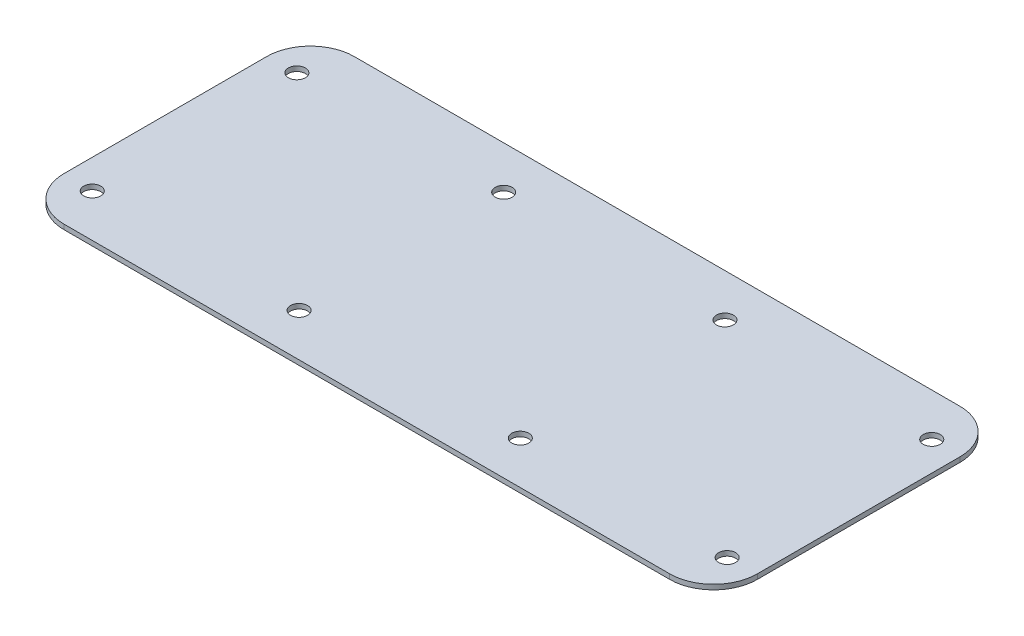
SolidWorks part; units mm, degrees
ref_plane "Front Plane" through (0, 0, 0) normal (0, 0, 1) x (1, 0, 0)
ref_plane "Top Plane" through (0, 0, 0) normal (0, 1, 0) x (1, 0, 0)
ref_plane "Right Plane" through (0, 0, 0) normal (1, 0, 0) x (0, 0, -1)
sketch "sk w14x665" plane through (0, 0, 0) normal (0, 1, 0) x (1, 0, 0)
  line L0 (-224.155, 274.828) -> (224.155, -274.828) construction
  point P1 (35.941, 0)
  line B0 (-224.155, -274.828) -> (-224.155, -160.02)
  line B1 (-224.155, -160.02) -> (-51.181, -160.02)
  line B2 (-35.941, -144.78) -> (-35.941, 144.78)
  line B3 (-51.181, 160.02) -> (-224.155, 160.02)
  line B4 (-224.155, 160.02) -> (-224.155, 274.828)
  line B5 (-224.155, 274.828) -> (224.155, 274.828)
  line B6 (224.155, 274.828) -> (224.155, 160.02)
  line B7 (224.155, 160.02) -> (51.181, 160.02)
  line B8 (35.941, 144.78) -> (35.941, -144.78)
  line B9 (51.181, -160.02) -> (224.155, -160.02)
  line B10 (224.155, -160.02) -> (224.155, -274.828)
  line B11 (224.155, -274.828) -> (-224.155, -274.828)
  line B12 (0, -346.9641) -> (0, 274.828) construction
  arc B13 (-51.181, -160.02) -> (-35.941, -144.78) centre (-51.181, -144.78) ccw
  arc B14 (-35.941, 144.78) -> (-51.181, 160.02) centre (-51.181, 144.78) ccw
  arc B15 (51.181, 160.02) -> (35.941, 144.78) centre (51.181, 144.78) ccw
  arc B16 (35.941, -144.78) -> (51.181, -160.02) centre (51.181, -144.78) ccw
sketch_block_instance "W14x665-1"
sketch_block "W14x665" parameters "D6"=15.24, "D1"=71.882, "D2"=448.31, "D3"=549.656, "D4"=114.808, "D5"=114.808, "D7"=35.941
ref_plane "midplane" through (0, 44.45, 0) normal (0, 1, 0) x (1, 0, 0)
sketch "clearance" plane through (0, 44.45, 0) normal (0, 1, 0) x (1, 0, 0)
  line L6 (-224.155, 274.828) -> (224.155, 274.828) construction
  line L7 (-224.155, 160.02) -> (-224.155, 274.828) construction
  line L8 (-51.181, 160.02) -> (-224.155, 160.02) construction
  line L9 (-35.941, -144.78) -> (-35.941, 144.78) construction
  line L10 (35.941, 144.78) -> (35.941, -144.78) construction
  line L12 (224.155, 274.828) -> (224.155, 160.02) construction
  line L13 (51.181, -160.02) -> (224.155, -160.02) construction
  line L14 (224.155, -274.828) -> (-224.155, -274.828) construction
  line L68 (-229.235, 271.5441) -> (-220.8711, 279.908)
  line L69 (-220.8711, 279.908) -> (220.8711, 279.908)
  line L70 (220.8711, 279.908) -> (229.235, 271.5441)
  line L71 (229.235, 271.5441) -> (229.235, 163.3039)
  line L72 (229.235, 163.3039) -> (220.8711, 154.94)
  line L73 (220.8711, 154.94) -> (50.0013, 154.94)
  line L74 (50.0013, 154.94) -> (41.021, 145.9597)
  line L75 (41.021, 145.9597) -> (41.021, -145.9597)
  line L76 (41.021, -145.9597) -> (50.0013, -154.94)
  line L77 (50.0013, -154.94) -> (220.8711, -154.94)
  line L78 (220.8711, -154.94) -> (229.235, -163.3039)
  line L79 (229.235, -163.3039) -> (229.235, -271.5441)
  line L80 (229.235, -271.5441) -> (220.8711, -279.908)
  line L81 (220.8711, -279.908) -> (-220.8711, -279.908)
  line L82 (-220.8711, -279.908) -> (-229.235, -271.5441)
  line L83 (-229.235, -271.5441) -> (-229.235, -163.3039)
  line L84 (-229.235, -163.3039) -> (-220.8711, -154.94)
  line L85 (-220.8711, -154.94) -> (-50.0013, -154.94)
  line L86 (-50.0013, -154.94) -> (-41.021, -145.9597)
  line L87 (-41.021, -145.9597) -> (-41.021, 145.9597)
  line L88 (-41.021, 145.9597) -> (-50.0013, 154.94)
  line L89 (-50.0013, 154.94) -> (-220.8711, 154.94)
  line L90 (-220.8711, 154.94) -> (-229.235, 163.3039)
  line L91 (-229.235, 163.3039) -> (-229.235, 271.5441)
  dimension "D3" = 1.27
  dimension "D4" = 45
  dimension "D5" = 45
  dimension "D6" = 1.27
  dimension "D7" = 5.08
  dimension "D8" = 1.27
  dimension "D9" = 5.08
  dimension "D10" = 5.08
  dimension "D11" = 5.08
  dimension "D12" = 5.08
  dimension "D13" = 1.27
  dimension "D14" = 5.08
  dimension "D15" = 1.27
  dimension "D16" = 5.08
  dimension "D17" = 12.7
  dimension "D18" = 1.27
  dimension "D19" = 5.08
  dimension "D20" = 12.7
  dimension "D21" = 12.7
  dimension "D22" = 12.7
  dimension "D23" = 1.27
  dimension "D24" = 1.27
sketch "bolt plate boundary" plane through (0, 0, 0) normal (0, 1, 0) x (1, 0, 0)
  line L7 (224.155, -274.828) -> (241.3488, -295.9087)
  line L8 (-220.8711, 279.908) -> (220.8711, 279.908) construction
  line L9 (-224.155, 274.828) -> (224.155, -274.828) construction
  line L10 (-41.021, -145.9597) -> (-41.021, 145.9597) construction
  line L11 (-224.155, 274.828) -> (-241.3488, 295.9087)
  line L12 (41.021, 145.9597) -> (41.021, -145.9597) construction
  line L15 (220.8711, -279.908) -> (-220.8711, -279.908) construction
  point P15 (0, -305.5874)
  point P16 (-66.7004, 0)
  point P17 (-308.3103, 362.8701)
  point P18 (-308.3103, 362.8701)
  point P19 (66.7004, 0)
  line B0 (-308.3103, 362.8701) -> (-350.8966, 289.1084) construction
  line B1 (-268.8989, 294.6076) -> (-229.4875, 362.8701)
  line B2 (-229.4875, 362.8701) -> (-268.8989, 431.1326)
  line B3 (-268.8989, 431.1326) -> (-347.7216, 431.1326)
  line B4 (-347.7216, 431.1326) -> (-387.133, 362.8701)
  line B5 (-387.133, 362.8701) -> (-347.7216, 294.6076)
  line B6 (-347.7216, 294.6076) -> (-268.8989, 294.6076)
  line B7 (-375.2717, 429.8316) -> (-241.3488, 295.9087) construction
  line B8 (-241.3488, 429.8316) -> (-375.2717, 295.9087) construction
  line B9 (-308.3103, 362.8701) -> (-282.9103, 362.8701) construction
  circle B10 centre (-308.3103, 362.8701) radius 44.45
  circle B11 centre (-308.3103, 362.8701) radius 68.2625 construction
  circle B12 centre (-308.3103, 362.8701) radius 85.1727
  circle B13 centre (-308.3103, 362.8701) radius 94.6977 construction
  line B14 (308.3103, -362.8701) -> (265.7239, -436.6319) construction
  line B15 (347.7216, -431.1326) -> (387.133, -362.8701)
  line B16 (387.133, -362.8701) -> (347.7216, -294.6076)
  line B17 (347.7216, -294.6076) -> (268.8989, -294.6076)
  line B18 (268.8989, -294.6076) -> (229.4875, -362.8701)
  line B19 (229.4875, -362.8701) -> (268.8989, -431.1326)
  line B20 (268.8989, -431.1326) -> (347.7216, -431.1326)
  line B21 (241.3488, -295.9087) -> (375.2717, -429.8316) construction
  line B22 (375.2717, -295.9087) -> (241.3488, -429.8316) construction
  line B23 (308.3103, -362.8701) -> (333.7103, -362.8701) construction
  circle B24 centre (308.3103, -362.8701) radius 44.45
  circle B25 centre (308.3103, -362.8701) radius 68.2625 construction
  circle B26 centre (308.3103, -362.8701) radius 85.1727
  circle B27 centre (308.3103, -362.8701) radius 94.6977 construction
  line B28 (39.4114, 468.5476) -> (-39.4114, 468.5476)
  line B29 (-78.8227, 400.2851) -> (-39.4114, 332.0226)
  line B30 (-39.4114, 332.0226) -> (39.4114, 332.0226)
  line B31 (-66.9614, 467.2466) -> (66.9614, 333.3237) construction
  line B32 (66.9614, 467.2466) -> (-66.9614, 333.3237) construction
  circle B33 centre (0, 400.2851) radius 44.45
  circle B34 centre (0, 400.2851) radius 68.2625 construction
  circle B35 centre (0, 400.2851) radius 85.1727
  circle B36 centre (0, 400.2851) radius 94.6977 construction
  line B37 (39.4114, -332.0226) -> (-39.4114, -332.0226)
  line B38 (-39.4114, -332.0226) -> (-78.8227, -400.2851)
  line B39 (-39.4114, -468.5476) -> (39.4114, -468.5476)
  line B40 (0, -400.2851) -> (25.4, -400.2851) construction
  circle B41 centre (0, -400.2851) radius 44.45
  circle B42 centre (0, -400.2851) radius 68.2625 construction
  circle B43 centre (0, -400.2851) radius 85.1727
  circle B44 centre (0, -400.2851) radius 94.6977 construction
  line B45 (-161.3981, 0) -> (-203.9845, -73.7618) construction
  line B46 (-82.5754, 0) -> (-121.9868, 68.2625)
  line B47 (-200.8095, 68.2625) -> (-240.2209, 0)
  line B48 (-240.2209, 0) -> (-200.8095, -68.2625)
  line B49 (-228.3596, 66.9614) -> (-94.4367, -66.9614) construction
  line B50 (-94.4367, 66.9614) -> (-228.3596, -66.9614) construction
  line B51 (-161.3981, 0) -> (-135.9981, 0) construction
  circle B52 centre (-161.3981, 0) radius 44.45
  circle B53 centre (-161.3981, 0) radius 68.2625 construction
  circle B54 centre (-161.3981, 0) radius 85.1727
  circle B55 centre (-161.3981, 0) radius 94.6977 construction
  line B56 (161.3981, 0) -> (118.8118, -73.7618) construction
  line B57 (200.8095, -68.2625) -> (240.2209, 0)
  line B58 (240.2209, 0) -> (200.8095, 68.2625)
  line B59 (200.8095, 68.2625) -> (121.9868, 68.2625)
  line B60 (121.9868, 68.2625) -> (82.5754, 0)
  line B61 (82.5754, 0) -> (121.9868, -68.2625)
  line B62 (94.4367, 66.9614) -> (228.3596, -66.9614) construction
  line B63 (228.3596, 66.9614) -> (94.4367, -66.9614) construction
  line B64 (161.3981, 0) -> (186.7981, 0) construction
  circle B65 centre (161.3981, 0) radius 44.45
  circle B66 centre (161.3981, 0) radius 68.2625 construction
  circle B67 centre (161.3981, 0) radius 85.1727
  circle B68 centre (161.3981, 0) radius 94.6977 construction
  dimension "D1" = 27.2034
  dimension "D2" = 25.6794
  dimension "D3" = 25.6794
  dimension "D4" = 25.6794
  dimension "D5" = 25.6794
  dimension "D6" = 27.2034
sketch_block_instance "3.5in bolt-3"
sketch_block "3.5in bolt" parameters "D1"=88.9, "D2"=136.525, "D3"=6.35, "D4"=40.7227, "D5"=45, "D6"=9.525
sketch_block_instance "3.5in bolt-4"
sketch_block_instance "3.5in bolt-5"
sketch_block_instance "3.5in bolt-6"
sketch_block_instance "3.5in bolt-7"
sketch_block_instance "3.5in bolt-8"
sketch "Sketch4" plane through (0, 0, 0) normal (0, 1, 0) x (1, 0, 0)
  line L1 (-403.008, 494.9829) -> (1520.1847, 494.9829)
  line L2 (-403.008, 494.9829) -> (-403.008, -494.9829)
  line L3 (-403.008, -494.9829) -> (1520.1847, -494.9829)
  line L4 (1520.1847, 494.9829) -> (1520.1847, -494.9829)
  circle A2 centre (0, 400.2851) radius 94.6977 construction
  circle A3 centre (-308.3103, 362.8701) radius 94.6977 construction
  circle A4 centre (0, -400.2851) radius 94.6977 construction
  dimension "D1" = 1358.7865
extrude "main plate" add sketch "Sketch4" along normal blind 12.7
sketch "sk bolt holes" plane through (0, 0, 0) normal (0, 1, 0) x (1, 0, 0)
  line L0 (808.8664, 362.8701) -> (808.8664, -362.8701) construction
  circle B0 centre (-308.3103, 362.8701) radius 46.0375
  circle B1 centre (0, 400.2851) radius 46.0375
  circle B2 centre (308.3103, 362.8701) radius 46.0375
  circle B3 centre (-308.3103, -362.8701) radius 46.0375
  circle B4 centre (0, -400.2851) radius 46.0375
  circle B5 centre (-161.3981, 0) radius 46.0375
  circle B6 centre (161.3981, 0) radius 46.0375
  circle B7 centre (308.3103, -362.8701) radius 46.0375
  circle B8 centre (0, 0) radius 76.2 construction
  circle B9 centre (808.8664, 362.8701) radius 46.0375
  circle B10 centre (1117.1767, 400.2851) radius 46.0375
  circle B11 centre (1425.4869, 362.8701) radius 46.0375
  circle B12 centre (808.8664, -362.8701) radius 46.0375
  circle B13 centre (1117.1767, -400.2851) radius 46.0375
  circle B14 centre (955.7785, 0) radius 46.0375
  circle B15 centre (1278.5748, 0) radius 46.0375
  circle B16 centre (1425.4869, -362.8701) radius 46.0375
  circle B17 centre (1117.1767, 0) radius 76.2 construction
  dimension "D1" = 1117.1767
sketch_block_instance "Block1-1"
sketch_block "Block1" parameters "D1"=92.075, "D2"=92.075, "D3"=92.075, "D4"=92.075, "D5"=92.075, "D6"=92.075, "D7"=92.075, "D8"=92.075, "D9"=152.4
sketch_block_instance "Block1-2"
extrude "Cut-Extrude2" [suppressed] cut sketch "sk bolt holes" along normal blind 88.9
fillet "Fillet1" radius 139.7 4 edges at (-403.008, 6.35, -494.9829) (1520.1847, 6.35, -494.9829) (1520.1847, 6.35, 494.9829) (-403.008, 6.35, 494.9829)
sketch "Sketch5" [suppressed] plane through (0, 9.525, 0) normal (0, 1, 0) x (1, 0, 0)
  line L1 (-517.2218, 542.3296) -> (487.0923, 542.3296)
  line L2 (-517.2218, 542.3296) -> (-517.2218, -547.3512)
  line L3 (-517.2218, -547.3512) -> (487.0923, -547.3512)
  line L4 (487.0923, 542.3296) -> (487.0923, -547.3512)
sketch "Sketch6" [suppressed] plane through (0, 0, 0) normal (0, 1, 0) x (1, 0, 0)
  line L0 (403.008, 355.2829) -> (403.008, -355.2829)
  line L1 (263.308, -494.9829) -> (172.4355, -494.9829) construction
  line L2 (263.308, 494.9829) -> (172.4355, 494.9829) construction
  line L3 (-403.008, 494.9829) -> (-403.008, -494.9829) construction
  line L4 (-403.008, 494.9829) -> (1520.1847, 494.9829) construction
  line L5 (-403.008, -494.9829) -> (1520.1847, -494.9829) construction
  line L6 (263.308, 494.9829) -> (263.308, 570.7306)
  line L7 (263.308, 570.7306) -> (1614.8608, 570.7306)
  line L8 (1614.8608, 570.7306) -> (1614.8608, -623.6767)
  line L9 (1614.8608, -623.6767) -> (263.308, -623.6767)
  line L10 (263.308, -623.6767) -> (263.308, -494.9829)
  arc A0 (403.008, -355.2829) -> (263.308, -494.9829) centre (263.308, -355.2829) cw
  arc A1 (403.008, 355.2829) -> (263.308, 494.9829) centre (263.308, 355.2829) ccw
  dimension "D2" = 139.7
  dimension "D1" = 806.016
extrude "Cut-Extrude3" [suppressed] cut sketch "Sketch6" along normal blind 25.4
sketch "Sketch7" plane through (0, 0, 0) normal (0, 1, 0) x (1, 0, 0)
  line L0 (-263.308, -494.9829) -> (1380.4847, -494.9829) construction
  line L1 (1380.4847, 494.9829) -> (-263.308, 494.9829) construction
  line L2 (1520.1847, -355.2829) -> (1520.1847, 355.2829) construction
  point P0 (0, 494.9829)
  point P4 (1117.1767, 494.9829)
  line B0 (403.008, 368.6679) -> (403.008, -368.6679)
  line B1 (314.108, -457.5679) -> (108.1676, -457.5679)
  line B2 (63.2663, -476.1666) -> (63.0487, -476.3842)
  line B3 (18.1474, -494.9829) -> (-18.1474, -494.9829)
  line B4 (-63.0487, -476.3842) -> (-63.2663, -476.1666)
  line B5 (-108.1676, -457.5679) -> (-314.108, -457.5679)
  line B6 (-403.008, -368.6679) -> (-403.008, 368.6679)
  line B7 (-314.108, 457.5679) -> (-108.1676, 457.5679)
  line B8 (-63.2663, 476.1666) -> (-63.0487, 476.3842)
  line B9 (-18.1474, 494.9829) -> (18.1474, 494.9829)
  line B10 (63.0487, 476.3842) -> (63.2663, 476.1666)
  line B11 (108.1676, 457.5679) -> (314.108, 457.5679)
  line B12 (-573.1445, 780.0685) -> (706.3295, 780.0685)
  line B13 (-573.1445, 780.0685) -> (-573.1445, -757.0177)
  line B14 (-573.1445, -757.0177) -> (706.3295, -757.0177)
  line B15 (706.3295, 780.0685) -> (706.3295, -757.0177)
  arc B16 (108.1676, -457.5679) -> (63.2663, -476.1666) centre (108.1676, -521.0679) ccw
  arc B17 (63.0487, -476.3842) -> (18.1474, -494.9829) centre (18.1474, -431.4829) cw
  arc B18 (-18.1474, -494.9829) -> (-63.0487, -476.3842) centre (-18.1474, -431.4829) cw
  arc B19 (-63.2663, -476.1666) -> (-108.1676, -457.5679) centre (-108.1676, -521.0679) ccw
  arc B20 (403.008, -368.6679) -> (314.108, -457.5679) centre (314.108, -368.6679) cw
  arc B21 (-314.108, -457.5679) -> (-403.008, -368.6679) centre (-314.108, -368.6679) cw
  arc B22 (403.008, 368.6679) -> (314.108, 457.5679) centre (314.108, 368.6679) ccw
  arc B23 (-403.008, 368.6679) -> (-314.108, 457.5679) centre (-314.108, 368.6679) cw
  arc B24 (63.2663, 476.1666) -> (108.1676, 457.5679) centre (108.1676, 521.0679) ccw
  arc B25 (18.1474, 494.9829) -> (63.0487, 476.3842) centre (18.1474, 431.4829) cw
  arc B26 (-63.0487, 476.3842) -> (-18.1474, 494.9829) centre (-18.1474, 431.4829) cw
  arc B27 (-108.1676, 457.5679) -> (-63.2663, 476.1666) centre (-108.1676, 521.0679) ccw
  line B28 (1520.1847, 368.6679) -> (1520.1847, -368.6679)
  line B29 (1431.2847, -457.5679) -> (1225.3442, -457.5679)
  line B30 (1099.0292, 494.9829) -> (1135.3241, 494.9829)
  line B31 (544.0322, 780.0685) -> (544.0322, -757.0177)
  line B32 (1823.5061, 780.0685) -> (1823.5061, -757.0177)
  arc B33 (1099.0292, -494.9829) -> (1054.1279, -476.3842) centre (1099.0292, -431.4829) cw
  arc B34 (1520.1847, 368.6679) -> (1431.2847, 457.5679) centre (1431.2847, 368.6679) ccw
  arc B35 (1180.443, 476.1666) -> (1225.3442, 457.5679) centre (1225.3442, 521.0679) ccw
  arc B36 (1135.3241, 494.9829) -> (1180.2254, 476.3842) centre (1135.3241, 431.4829) cw
  arc B37 (1054.1279, 476.3842) -> (1099.0292, 494.9829) centre (1099.0292, 431.4829) cw
sketch_block_instance "Block2-1"
sketch_block "Block2"
sketch_block_instance "Block2-3"
sketch "Sketch9" plane through (0, 0, 0) normal (0, 1, 0) x (1, 0, 0)
  line L0 (-403.008, 368.6679) -> (-403.008, -368.6679)
  line L1 (-314.108, -457.5679) -> (-108.1676, -457.5679)
  line L2 (-63.2663, -476.1666) -> (-63.0487, -476.3842)
  line L3 (-18.1474, -494.9829) -> (1135.3241, -494.9829)
  line L4 (1180.2254, -476.3842) -> (1180.443, -476.1666)
  line L5 (1225.3442, -457.5679) -> (1431.2847, -457.5679)
  line L6 (1520.1847, -368.6679) -> (1520.1847, 368.6679)
  line L7 (1431.2847, 457.5679) -> (1225.3442, 457.5679)
  line L8 (1180.443, 476.1666) -> (1180.2254, 476.3842)
  line L9 (1135.3241, 494.9829) -> (-18.1474, 494.9829)
  line L10 (-63.0487, 476.3842) -> (-63.2663, 476.1666)
  line L11 (-108.1676, 457.5679) -> (-314.108, 457.5679)
  line L13 (108.1676, 457.5679) -> (314.108, 457.5679) construction
  line L14 (-403.008, -368.6679) -> (-403.008, 368.6679) construction
  line L15 (1520.1847, 368.6679) -> (1520.1847, -368.6679) construction
  line L16 (-314.108, 457.5679) -> (-108.1676, 457.5679) construction
  line L17 (-108.1676, -457.5679) -> (-314.108, -457.5679) construction
  line L18 (-18.1474, 494.9829) -> (18.1474, 494.9829) construction
  line L20 (-465.7609, 588.4229) -> (1596.5512, 588.4229)
  line L21 (-465.7609, 588.4229) -> (-465.7609, -605.7123)
  line L22 (-465.7609, -605.7123) -> (1596.5512, -605.7123)
  line L23 (1596.5512, 588.4229) -> (1596.5512, -605.7123)
  arc A0 (-403.008, -368.6679) -> (-314.108, -457.5679) centre (-314.108, -368.6679) ccw
  arc A1 (1431.2847, -457.5679) -> (1520.1847, -368.6679) centre (1431.2847, -368.6679) ccw
  arc A2 (1520.1847, 368.6679) -> (1431.2847, 457.5679) centre (1431.2847, 368.6679) ccw
  arc A3 (-314.108, 457.5679) -> (-403.008, 368.6679) centre (-314.108, 368.6679) ccw
  arc A4 (-108.1676, -457.5679) -> (-63.2663, -476.1666) centre (-108.1676, -521.0679) cw
  arc A5 (-63.0487, -476.3842) -> (-18.1474, -494.9829) centre (-18.1474, -431.4829) ccw
  arc A6 (1135.3241, -494.9829) -> (1180.2254, -476.3842) centre (1135.3241, -431.4829) ccw
  arc A7 (1180.443, -476.1666) -> (1225.3442, -457.5679) centre (1225.3442, -521.0679) cw
  arc A8 (1225.3442, 457.5679) -> (1180.443, 476.1666) centre (1225.3442, 521.0679) cw
  arc A9 (1180.2254, 476.3842) -> (1135.3241, 494.9829) centre (1135.3241, 431.4829) ccw
  arc A10 (-18.1474, 494.9829) -> (-63.0487, 476.3842) centre (-18.1474, 431.4829) ccw
  arc A11 (-63.2663, 476.1666) -> (-108.1676, 457.5679) centre (-108.1676, 521.0679) cw
  dimension "D2" = 88.9
  dimension "D3" = 63.5
  dimension "D1" = 45
extrude "Cut-Extrude4" cut sketch "Sketch9" along normal blind 25.4
sketch "Sketch10" plane through (0, 0, 0) normal (0, 1, 0) x (1, 0, 0)
  line L13 (-644.5898, 615.729) -> (1787.4754, 615.729)
  line L14 (-644.5898, 615.729) -> (-644.5898, -731.4192)
  line L15 (-644.5898, -731.4192) -> (1787.4754, -731.4192)
  line L16 (1787.4754, 615.729) -> (1787.4754, -731.4192)
  line L24 (1225.3442, -444.8679) -> (1431.2847, -444.8679)
  line L25 (1171.2451, -467.4039) -> (1171.4627, -467.1863)
  line L26 (-18.1474, -482.2829) -> (1135.3241, -482.2829)
  line L27 (-54.286, -467.1863) -> (-54.0685, -467.4039)
  line L28 (-314.108, -444.8679) -> (-108.1676, -444.8679)
  line L29 (-390.308, 355.2829) -> (-390.308, -355.2829)
  line L30 (-108.1676, 444.8679) -> (-314.108, 444.8679)
  line L31 (-54.0685, 467.4039) -> (-54.286, 467.1863)
  line L32 (1135.3241, 482.2829) -> (-18.1474, 482.2829)
  line L33 (1171.4627, 467.1863) -> (1171.2451, 467.4039)
  line L34 (1431.2847, 444.8679) -> (1225.3442, 444.8679)
  line L35 (1507.4847, -355.2829) -> (1507.4847, 355.2829)
  line L36 (1225.3442, -444.8679) -> (1431.2847, -444.8679)
  line L37 (1171.2451, -467.4039) -> (1171.4627, -467.1863)
  line L38 (-18.1474, -482.2829) -> (1135.3241, -482.2829)
  line L39 (-54.286, -467.1863) -> (-54.0685, -467.4039)
  line L40 (-314.108, -444.8679) -> (-108.1676, -444.8679)
  line L41 (-390.308, 355.2829) -> (-390.308, -355.2829)
  line L42 (-108.1676, 444.8679) -> (-314.108, 444.8679)
  line L43 (-54.0685, 467.4039) -> (-54.286, 467.1863)
  line L44 (1135.3241, 482.2829) -> (-18.1474, 482.2829)
  line L45 (1171.4627, 467.1863) -> (1171.2451, 467.4039)
  line L46 (1431.2847, 444.8679) -> (1225.3442, 444.8679)
  line L47 (1507.4847, -355.2829) -> (1507.4847, 355.2829)
  arc A32 (-377.3411, -411.1887) -> (-314.108, -444.8679) centre (-314.108, -368.6679) ccw
  arc A33 (1431.2847, -444.8679) -> (1494.5178, -411.1887) centre (1431.2847, -368.6679) ccw
  arc A34 (1225.3442, -444.8679) -> (1171.4627, -467.1863) centre (1225.3442, -521.0679) ccw
  arc A35 (1135.3241, -482.2829) -> (1171.2451, -467.4039) centre (1135.3241, -431.4829) ccw
  arc A36 (-54.0685, -467.4039) -> (-18.1474, -482.2829) centre (-18.1474, -431.4829) ccw
  arc A37 (-54.286, -467.1863) -> (-108.1676, -444.8679) centre (-108.1676, -521.0679) ccw
  arc A38 (-390.308, -355.2829) -> (-377.3411, -411.1887) centre (-263.308, -355.2829) ccw
  arc A39 (-377.3411, 411.1887) -> (-390.308, 355.2829) centre (-263.308, 355.2829) ccw
  arc A40 (1494.5178, 411.1887) -> (1431.2847, 444.8679) centre (1431.2847, 368.6679) ccw
  arc A41 (-314.108, 444.8679) -> (-377.3411, 411.1887) centre (-314.108, 368.6679) ccw
  arc A42 (-108.1676, 444.8679) -> (-54.286, 467.1863) centre (-108.1676, 521.0679) ccw
  arc A43 (-18.1474, 482.2829) -> (-54.0685, 467.4039) centre (-18.1474, 431.4829) ccw
  arc A44 (1171.2451, 467.4039) -> (1135.3241, 482.2829) centre (1135.3241, 431.4829) ccw
  arc A45 (1171.4627, 467.1863) -> (1225.3442, 444.8679) centre (1225.3442, 521.0679) ccw
  arc A46 (1507.4847, 355.2829) -> (1494.5178, 411.1887) centre (1380.4847, 355.2829) ccw
  arc A47 (1494.5178, -411.1887) -> (1507.4847, -355.2829) centre (1380.4847, -355.2829) ccw
  arc A48 (-377.3411, -411.1887) -> (-314.108, -444.8679) centre (-314.108, -368.6679) ccw
  arc A49 (1431.2847, -444.8679) -> (1494.5178, -411.1887) centre (1431.2847, -368.6679) ccw
  arc A50 (1225.3442, -444.8679) -> (1171.4627, -467.1863) centre (1225.3442, -521.0679) ccw
  arc A51 (1135.3241, -482.2829) -> (1171.2451, -467.4039) centre (1135.3241, -431.4829) ccw
  arc A52 (-54.0685, -467.4039) -> (-18.1474, -482.2829) centre (-18.1474, -431.4829) ccw
  arc A53 (-54.286, -467.1863) -> (-108.1676, -444.8679) centre (-108.1676, -521.0679) ccw
  arc A54 (-390.308, -355.2829) -> (-377.3411, -411.1887) centre (-263.308, -355.2829) ccw
  arc A55 (-377.3411, 411.1887) -> (-390.308, 355.2829) centre (-263.308, 355.2829) ccw
  arc A56 (1494.5178, 411.1887) -> (1431.2847, 444.8679) centre (1431.2847, 368.6679) ccw
  arc A57 (-314.108, 444.8679) -> (-377.3411, 411.1887) centre (-314.108, 368.6679) ccw
  arc A58 (-108.1676, 444.8679) -> (-54.286, 467.1863) centre (-108.1676, 521.0679) ccw
  arc A59 (-18.1474, 482.2829) -> (-54.0685, 467.4039) centre (-18.1474, 431.4829) ccw
  arc A60 (1171.2451, 467.4039) -> (1135.3241, 482.2829) centre (1135.3241, 431.4829) ccw
  arc A61 (1171.4627, 467.1863) -> (1225.3442, 444.8679) centre (1225.3442, 521.0679) ccw
  arc A62 (1507.4847, 355.2829) -> (1494.5178, 411.1887) centre (1380.4847, 355.2829) ccw
  arc A63 (1494.5178, -411.1887) -> (1507.4847, -355.2829) centre (1380.4847, -355.2829) ccw
  dimension "D1" = 12.7
extrude "Cut-Extrude5" cut sketch "Sketch10" along normal through all
sketch "Sketch11" plane through (0, 0, 0) normal (0, 1, 0) x (1, 0, 0)
  circle A2 centre (-308.3103, 362.8701) radius 46.0375 construction
  circle A3 centre (0, 400.2851) radius 46.0375 construction
  circle A4 centre (308.3103, 362.8701) radius 46.0375 construction
  circle A5 centre (-161.3981, 0) radius 46.0375 construction
  circle A6 centre (161.3981, 0) radius 46.0375 construction
  circle A7 centre (-308.3103, -362.8701) radius 46.0375 construction
  circle A8 centre (0, -400.2851) radius 46.0375 construction
  circle A9 centre (308.3103, -362.8701) radius 46.0375 construction
  circle A10 centre (1425.4869, 362.8701) radius 46.0375 construction
  circle A11 centre (1117.1767, 400.2851) radius 46.0375 construction
  circle A12 centre (808.8664, 362.8701) radius 46.0375 construction
  circle A13 centre (955.7785, 0) radius 46.0375 construction
  circle A14 centre (1278.5748, 0) radius 46.0375 construction
  circle A15 centre (808.8664, -362.8701) radius 46.0375 construction
  circle A16 centre (1117.1767, -400.2851) radius 46.0375 construction
  circle A17 centre (1425.4869, -362.8701) radius 46.0375 construction
  circle B0 centre (-308.3103, 362.8701) radius 35.7188
  circle B1 centre (-308.3103, 362.8701) radius 46.99
  circle B2 centre (308.3103, 362.8701) radius 35.7188
  circle B3 centre (308.3103, 362.8701) radius 46.99
  circle B4 centre (0, 400.2851) radius 35.7188
  circle B5 centre (0, 400.2851) radius 46.99
  circle B6 centre (-161.3981, 0) radius 35.7188
  circle B7 centre (-161.3981, 0) radius 46.99
  circle B8 centre (161.3981, 0) radius 35.7188
  circle B9 centre (161.3981, 0) radius 46.99
  circle B10 centre (-308.3103, -362.8701) radius 35.7188
  circle B11 centre (-308.3103, -362.8701) radius 46.99
  circle B12 centre (0, -400.2851) radius 35.7188
  circle B13 centre (0, -400.2851) radius 46.99
  circle B14 centre (308.3103, -362.8701) radius 35.7188
  circle B15 centre (308.3103, -362.8701) radius 46.99
  circle B16 centre (1425.4869, 362.8701) radius 35.7188
  circle B17 centre (1425.4869, 362.8701) radius 46.99
  circle B18 centre (1117.1767, 400.2851) radius 35.7188
  circle B19 centre (1117.1767, 400.2851) radius 46.99
  circle B20 centre (808.8664, 362.8701) radius 35.7188
  circle B21 centre (808.8664, 362.8701) radius 46.99
  circle B22 centre (955.7785, 0) radius 35.7188
  circle B23 centre (955.7785, 0) radius 46.99
  circle B24 centre (1278.5748, 0) radius 35.7188
  circle B25 centre (1278.5748, 0) radius 46.99
  circle B26 centre (808.8664, -362.8701) radius 35.7188
  circle B27 centre (808.8664, -362.8701) radius 46.99
  circle B28 centre (1117.1767, -400.2851) radius 35.7188
  circle B29 centre (1117.1767, -400.2851) radius 46.99
  circle B30 centre (1425.4869, -362.8701) radius 35.7188
  circle B31 centre (1425.4869, -362.8701) radius 46.99
sketch_block_instance "Block3-1"
sketch_block "Block3" parameters "D1"=71.4375, "D2"=93.98
sketch_block_instance "Block3-2"
sketch_block_instance "Block3-3"
sketch_block_instance "Block3-4"
sketch_block_instance "Block3-5"
sketch_block_instance "Block3-6"
sketch_block_instance "Block3-7"
sketch_block_instance "Block3-8"
sketch_block_instance "Block3-9"
sketch_block_instance "Block3-10"
sketch_block_instance "Block3-11"
sketch_block_instance "Block3-12"
sketch_block_instance "Block3-13"
sketch_block_instance "Block3-14"
sketch_block_instance "Block3-15"
sketch_block_instance "Block3-16"
extrude "Boss-Extrude1" [suppressed] add sketch "Sketch11" along normal blind 12.7
sketch "Sketch13" plane through (0, 0, 0) normal (0, 1, 0) x (1, 0, 0)
  line L0 (-284.2097, 311.9592) -> (284.2097, -311.9592) construction
  line L1 (284.2097, -311.9592) -> (-284.2097, -311.9592) construction
  line L2 (832.967, 311.9592) -> (1401.3864, -311.9592) construction
  line L3 (1401.3864, -311.9592) -> (832.967, -311.9592) construction
  point P5 (1117.1767, 0)
  point P7 (0, 0)
  circle B0 centre (-284.2097, 311.9592) radius 32.5438
  circle B1 centre (0, 347.5192) radius 32.5437
  circle B2 centre (284.2097, 311.9592) radius 32.5438
  circle B3 centre (-161.544, 0) radius 32.5437
  circle B4 centre (161.544, 0) radius 32.5438
  circle B5 centre (284.2097, -311.9592) radius 32.5437
  circle B6 centre (0, -347.5192) radius 32.5437
  circle B7 centre (-284.2097, -311.9592) radius 32.5438
  circle B8 centre (832.967, 311.9592) radius 32.5438
  circle B9 centre (1117.1767, 347.5192) radius 32.5437
  circle B10 centre (1401.3864, 311.9592) radius 32.5438
  circle B11 centre (955.6327, 0) radius 32.5437
  circle B12 centre (1278.7207, 0) radius 32.5438
  circle B13 centre (1401.3864, -311.9592) radius 32.5437
  circle B14 centre (1117.1767, -347.5192) radius 32.5437
  circle B15 centre (832.967, -311.9592) radius 32.5438
sketch_block_instance "Block5-1"
sketch_block "Block5" parameters "D1"=65.0875, "D2"=65.0875, "D3"=65.0875, "D4"=65.0875, "D5"=65.0875, "D6"=65.0875, "D7"=65.0875, "D8"=65.0875
sketch_block_instance "Block5-2"
sketch "mountplates" plane through (0, 0, 0) normal (0, 1, 0) x (1, 0, 0)
  line L0 (-246.1097, 309.4192) -> (246.1097, -309.4192) construction
  line L10 (871.067, 309.4192) -> (1363.2864, -309.4192) construction
  point P2 (0, 0)
  point P5 (1117.1767, 0)
  line B0 (-246.1097, 423.7192) -> (246.1097, 423.7192)
  line B1 (-360.4097, 309.4192) -> (-360.4097, -309.4192)
  line B2 (-246.1097, -423.7192) -> (246.1097, -423.7192)
  line B3 (360.4097, 309.4192) -> (360.4097, -309.4192)
  arc B4 (-360.4097, -309.4192) -> (-246.1097, -423.7192) centre (-246.1097, -309.4192) ccw
  arc B5 (246.1097, -423.7192) -> (360.4097, -309.4192) centre (246.1097, -309.4192) ccw
  arc B6 (246.1097, 423.7192) -> (360.4097, 309.4192) centre (246.1097, 309.4192) cw
  arc B7 (-246.1097, 423.7192) -> (-360.4097, 309.4192) centre (-246.1097, 309.4192) ccw
  line B8 (871.067, 423.7192) -> (1363.2864, 423.7192)
  line B9 (756.767, 309.4192) -> (756.767, -309.4192)
  line B10 (871.067, -423.7192) -> (1363.2864, -423.7192)
  line B11 (1477.5864, 309.4192) -> (1477.5864, -309.4192)
  arc B12 (756.767, -309.4192) -> (871.067, -423.7192) centre (871.067, -309.4192) ccw
sketch_block_instance "Block6-1"
sketch_block "Block6" parameters "D1"=114.3, "D2"=720.8194, "D3"=847.4384
sketch_block_instance "Block6-2"
sketch "Sketch15" plane through (0, 0, 0) normal (0, 1, 0) x (1, 0, 0)
  line L0 (-246.1097, 423.7192) -> (246.1097, 423.7192) construction
  line L1 (-246.1097, 423.7192) -> (1363.2864, 423.7192)
  line L2 (-360.4097, 309.4192) -> (-360.4097, -309.4192)
  line L3 (-246.1097, -423.7192) -> (1363.2864, -423.7192)
  line L4 (1477.5864, 309.4192) -> (1477.5864, -309.4192)
  line L5 (-360.4097, 309.4192) -> (-360.4097, -309.4192) construction
  line L6 (-246.1097, -423.7192) -> (246.1097, -423.7192) construction
  line L7 (1477.5864, 309.4192) -> (1477.5864, -309.4192) construction
  line L9 (-507.665, 564.7648) -> (1634.7064, 564.7648)
  line L10 (-507.665, 564.7648) -> (-507.665, -637.7083)
  line L11 (-507.665, -637.7083) -> (1634.7064, -637.7083)
  line L12 (1634.7064, 564.7648) -> (1634.7064, -637.7083)
  arc A0 (1363.2864, -423.7192) -> (1477.5864, -309.4192) centre (1363.2864, -309.4192) ccw
  arc A1 (1363.2864, 423.7192) -> (1477.5864, 309.4192) centre (1363.2864, 309.4192) cw
  arc A2 (-360.4097, -309.4192) -> (-246.1097, -423.7192) centre (-246.1097, -309.4192) ccw
  arc A3 (-246.1097, 423.7192) -> (-360.4097, 309.4192) centre (-246.1097, 309.4192) ccw
  dimension "D1" = 114.3
extrude "Cut-Extrude6" [suppressed] cut sketch "Sketch13" along normal through all
extrude "Cut-Extrude7" [suppressed] cut sketch "Sketch15" along normal through all
sketch "Sketch16" plane through (0, 0, 0) normal (0, 1, 0) x (1, 0, 0)
  line L0 (-279.6377, 297.9892) -> (279.6377, -297.9892) construction
  line L1 (279.6377, -297.9892) -> (-279.6377, -297.9892) construction
  line L2 (837.539, 297.9892) -> (1396.8144, -297.9892) construction
  line L3 (1396.8144, -297.9892) -> (837.539, -297.9892) construction
  point P6 (0, 0)
  point P7 (1117.1767, 0)
  circle B0 centre (-279.6377, 297.9892) radius 29.3687
  circle B1 centre (0, 333.5492) radius 29.3688
  circle B2 centre (279.6377, 297.9892) radius 29.3687
  circle B3 centre (-161.544, 0) radius 29.3687
  circle B4 centre (161.544, 0) radius 29.3688
  circle B5 centre (279.6377, -297.9892) radius 29.3687
  circle B6 centre (0, -333.5492) radius 29.3688
  circle B7 centre (-279.6377, -297.9892) radius 29.3687
  circle B8 centre (837.539, 297.9892) radius 29.3687
  circle B9 centre (1117.1767, 333.5492) radius 29.3688
  circle B10 centre (1396.8144, 297.9892) radius 29.3687
  circle B11 centre (955.6327, 0) radius 29.3687
  circle B12 centre (1278.7207, 0) radius 29.3688
  circle B13 centre (1396.8144, -297.9892) radius 29.3687
  circle B14 centre (1117.1767, -333.5492) radius 29.3688
  circle B15 centre (837.539, -297.9892) radius 29.3687
sketch_block_instance "Block7-1"
sketch_block "Block7"
sketch_block_instance "Block7-2"
sketch "Sketch17" plane through (0, 0, 0) normal (0, 1, 0) x (1, 0, 0)
  line L0 (-241.5377, 295.4492) -> (241.5377, -295.4492)
  line L1 (875.639, 295.4492) -> (1358.7144, -295.4492)
  point P2 (0, 0)
  point P5 (1117.1767, 0)
  line B0 (-241.5377, 409.7492) -> (241.5377, 409.7492)
  line B1 (-241.5377, -409.7492) -> (241.5377, -409.7492)
  line B2 (-355.8377, 295.4492) -> (-355.8377, -295.4492)
  arc B3 (-241.5377, -409.7492) -> (-355.8377, -295.4492) centre (-241.5377, -295.4492) cw
  line B4 (875.639, -409.7492) -> (1358.7144, -409.7492)
  line B5 (1473.0144, 295.4492) -> (1473.0144, -295.4492)
sketch_block_instance "Block7-1"
sketch_block "Block8" parameters "D1"=114.3
sketch_block_instance "Block8-1"
sketch "Sketch18" plane through (0, 0, 0) normal (0, 1, 0) x (1, 0, 0)
  line L0 (-241.5377, 409.7492) -> (241.5377, 409.7492) construction
  line L1 (-241.5377, 409.7492) -> (1358.7144, 409.7492)
  line L2 (-355.8377, 295.4492) -> (-355.8377, -295.4492)
  line L3 (-241.5377, -409.7492) -> (1358.7144, -409.7492)
  line L4 (1473.0144, 295.4492) -> (1473.0144, -295.4492)
  line L5 (-355.8377, 295.4492) -> (-355.8377, -295.4492) construction
  line L6 (-241.5377, -409.7492) -> (241.5377, -409.7492) construction
  line L7 (1473.0144, 295.4492) -> (1473.0144, -295.4492) construction
  line L9 (-548.0691, 576.5442) -> (1657.0969, 576.5442)
  line L10 (-548.0691, 576.5442) -> (-548.0691, -597.5374)
  line L11 (-548.0691, -597.5374) -> (1657.0969, -597.5374)
  line L12 (1657.0969, 576.5442) -> (1657.0969, -597.5374)
  arc A0 (1358.7144, -409.7492) -> (1473.0144, -295.4492) centre (1358.7144, -295.4492) ccw
  arc A1 (1358.7144, 409.7492) -> (1473.0144, 295.4492) centre (1358.7144, 295.4492) cw
  arc A2 (-355.8377, -295.4492) -> (-241.5377, -409.7492) centre (-241.5377, -295.4492) ccw
  arc A3 (-241.5377, 409.7492) -> (-355.8377, 295.4492) centre (-241.5377, 295.4492) ccw
  dimension "D1" = 114.3
extrude "Cut-Extrude8" [suppressed] cut sketch "Sketch16" along normal through all
extrude "Cut-Extrude9" [suppressed] cut sketch "Sketch18" along normal through all
sketch "Sketch19" plane through (0, 0, 0) normal (0, 1, 0) x (1, 0, 0)
  circle B0 centre (-275.0022, 283.0032) radius 23.0187
  circle B1 centre (0, 318.5632) radius 23.0187
  circle B2 centre (275.0022, 283.0032) radius 23.0187
  circle B3 centre (-161.544, 0) radius 23.0187
  circle B4 centre (161.544, 0) radius 23.0188
  circle B5 centre (275.0022, -283.0032) radius 23.0187
  circle B6 centre (0, -318.5632) radius 23.0187
  circle B7 centre (-275.0022, -283.0032) radius 23.0187
  line B8 (275.0022, -283.0032) -> (-275.0022, -283.0032) construction
  circle B9 centre (842.1745, 283.0032) radius 23.0187
  circle B10 centre (1117.1767, 318.5632) radius 23.0187
  circle B11 centre (1392.1789, 283.0032) radius 23.0187
  circle B12 centre (955.6327, 0) radius 23.0187
  circle B13 centre (1278.7207, 0) radius 23.0188
  circle B14 centre (1392.1789, -283.0032) radius 23.0187
  circle B15 centre (1117.1767, -318.5632) radius 23.0187
  circle B16 centre (842.1745, -283.0032) radius 23.0187
  line B17 (1392.1789, -283.0032) -> (842.1745, -283.0032) construction
sketch_block_instance "Block9-1"
sketch_block "Block9" parameters "D1"=46.0375, "D2"=46.0375, "D3"=46.0375, "D4"=46.0375, "D5"=46.0375, "D6"=46.0375, "D7"=46.0375, "D8"=46.0375
sketch_block_instance "Block9-2"
sketch "Sketch20" plane through (0, 0, 0) normal (0, 1, 0) x (1, 0, 0)
  line B0 (-236.9022, 394.7632) -> (236.9022, 394.7632)
  line B1 (-236.9022, -394.7632) -> (236.9022, -394.7632)
  line B2 (-351.2022, 280.4632) -> (-351.2022, -280.4632)
  line B3 (351.2022, 280.4632) -> (351.2022, -280.4632)
  line B4 (-611.5624, 602.8787) -> (624.0589, 602.8787)
  line B5 (624.0589, 602.8787) -> (624.0589, -644.1484)
  line B6 (-236.9022, 280.4632) -> (236.9022, -280.4632) construction
  arc B7 (-351.2022, 280.4632) -> (-236.9022, 394.7632) centre (-236.9022, 280.4632) cw
  line B8 (880.2745, 394.7632) -> (1354.0789, 394.7632)
  line B9 (880.2745, -394.7632) -> (1354.0789, -394.7632)
  line B10 (1468.3789, 280.4632) -> (1468.3789, -280.4632)
  line B11 (505.6142, 602.8787) -> (505.6142, -644.1484)
  line B12 (505.6142, -644.1484) -> (1741.2356, -644.1484)
  line B13 (1741.2356, 602.8787) -> (1741.2356, -644.1484)
  arc B14 (1354.0789, -394.7632) -> (1468.3789, -280.4632) centre (1354.0789, -280.4632) ccw
sketch_block_instance "Block10-1"
sketch_block "Block10"
sketch_block_instance "Block10-2"
sketch "Sketch21" plane through (0, 0, 0) normal (0, 1, 0) x (1, 0, 0)
  line L0 (-236.9022, 394.7632) -> (236.9022, 394.7632) construction
  line L1 (-236.9022, 394.7632) -> (1354.0789, 394.7632)
  line L2 (-351.2022, 280.4632) -> (-351.2022, -280.4632)
  line L3 (-236.9022, -394.7632) -> (1354.0789, -394.7632)
  line L4 (1468.3789, 280.4632) -> (1468.3789, -280.4632)
  line L5 (-236.9022, -394.7632) -> (236.9022, -394.7632) construction
  line L6 (-351.2022, 280.4632) -> (-351.2022, -280.4632) construction
  line L7 (1468.3789, 280.4632) -> (1468.3789, -280.4632) construction
  line L9 (-474.6908, 579.1217) -> (1652.0223, 579.1217)
  line L10 (-474.6908, 579.1217) -> (-474.6908, -608.1315)
  line L11 (-474.6908, -608.1315) -> (1652.0223, -608.1315)
  line L12 (1652.0223, 579.1217) -> (1652.0223, -608.1315)
  arc A0 (1354.0789, 394.7632) -> (1468.3789, 280.4632) centre (1354.0789, 280.4632) cw
  arc A1 (1354.0789, -394.7632) -> (1468.3789, -280.4632) centre (1354.0789, -280.4632) ccw
  arc A2 (-351.2022, -280.4632) -> (-236.9022, -394.7632) centre (-236.9022, -280.4632) ccw
  arc A3 (-236.9022, 394.7632) -> (-351.2022, 280.4632) centre (-236.9022, 280.4632) ccw
  dimension "D1" = 114.3
extrude "Cut-Extrude10" [suppressed] cut sketch "Sketch19" along normal through all
extrude "Cut-Extrude11" [suppressed] cut sketch "Sketch21" along normal through all
sketch "Sketch22" plane through (0, 0, 0) normal (0, 1, 0) x (1, 0, 0)
  line B0 (-231.8222, 378.7612) -> (231.8222, 378.7612)
  line B1 (-231.8222, -378.7612) -> (231.8222, -378.7612)
  line B2 (-346.1222, 264.4612) -> (-346.1222, -264.4612)
  line B3 (885.3545, -378.7612) -> (1348.9989, -378.7612)
  line B4 (1463.2989, 264.4612) -> (1463.2989, -264.4612)
sketch_block_instance "Block14-1"
sketch_block "Block14"
sketch_block_instance "Block14-2"
sketch "Sketch23" plane through (0, 0, 0) normal (0, 1, 0) x (1, 0, 0)
  line B0 (269.9222, -267.0012) -> (-269.9222, -267.0012) construction
  circle B1 centre (-269.9222, 267.0012) radius 26.1937
  circle B2 centre (269.9222, 267.0012) radius 26.1938
  circle B3 centre (269.9222, -267.0012) radius 26.1937
  circle B4 centre (-269.9222, -267.0012) radius 26.1938
  line B5 (1387.0989, -267.0012) -> (847.2545, -267.0012) construction
  circle B6 centre (847.2545, 267.0012) radius 26.1937
  circle B7 centre (1387.0989, 267.0012) radius 26.1938
  circle B8 centre (1387.0989, -267.0012) radius 26.1937
  circle B9 centre (847.2545, -267.0012) radius 26.1938
sketch_block_instance "Block13-1"
sketch_block "Block13" parameters "D1"=52.3875, "D2"=52.3875, "D3"=52.3875, "D4"=52.3875, "D5"=52.3875, "D6"=52.3875, "D7"=52.3875, "D8"=52.3875
sketch_block_instance "Block13-2"
sketch "Sketch24" plane through (0, 0, 0) normal (0, 1, 0) x (1, 0, 0)
  line L9 (-465.2536, 568.222) -> (1636.2131, 568.222)
  line L10 (-465.2536, 568.222) -> (-465.2536, -553.5904)
  line L11 (-465.2536, -553.5904) -> (1636.2131, -553.5904)
  line L12 (1636.2131, 568.222) -> (1636.2131, -553.5904)
  line L13 (-231.8222, 378.7612) -> (1348.9989, 378.7612)
  line L14 (-346.1222, 264.4612) -> (-346.1222, -264.4612)
  line L15 (-231.8222, -378.7612) -> (1348.9989, -378.7612)
  line L16 (1463.2989, 264.4612) -> (1463.2989, -264.4612)
  line L18 (-231.8222, -378.7612) -> (231.8222, -378.7612) construction
  line L22 (-231.8222, 378.7612) -> (231.8222, 378.7612) construction
  line L23 (-346.1222, 264.4612) -> (-346.1222, -264.4612) construction
  line L24 (1463.2989, 264.4612) -> (1463.2989, -264.4612) construction
  arc A4 (1348.9989, 378.7612) -> (1463.2989, 264.4612) centre (1348.9989, 264.4612) cw
  arc A5 (1348.9989, -378.7612) -> (1463.2989, -264.4612) centre (1348.9989, -264.4612) ccw
  arc A6 (-231.8222, -378.7612) -> (-346.1222, -264.4612) centre (-231.8222, -264.4612) cw
  arc A7 (-231.8222, 378.7612) -> (-346.1222, 264.4612) centre (-231.8222, 264.4612) ccw
  dimension "D1" = 114.3
extrude "Cut-Extrude12" cut sketch "Sketch23" along normal through all
extrude "Cut-Extrude13" cut sketch "Sketch24" along normal through all
sketch "Sketch25" plane through (0, 0, 0) normal (0, 1, 0) x (1, 0, 0)
  circle A2 centre (-269.9222, 267.0012) radius 26.1937 construction
  circle A3 centre (269.9222, 267.0012) radius 26.1938 construction
  circle A4 centre (847.2545, 267.0012) radius 26.1937 construction
  circle A5 centre (1387.0989, 267.0012) radius 26.1938 construction
  circle A6 centre (-269.9222, -267.0012) radius 26.1938 construction
  circle A7 centre (269.9222, -267.0012) radius 26.1938 construction
  circle A8 centre (847.2545, -267.0012) radius 26.1938 construction
  circle A9 centre (1387.0989, -267.0012) radius 26.1938 construction
  circle B0 centre (-269.9222, 267.0012) radius 22.225
  circle B1 centre (-269.9222, 267.0012) radius 31.75
  circle B2 centre (269.9222, 267.0012) radius 22.225
  circle B3 centre (269.9222, 267.0012) radius 31.75
  circle B4 centre (847.2545, 267.0012) radius 22.225
  circle B5 centre (847.2545, 267.0012) radius 31.75
  circle B6 centre (1387.0989, 267.0012) radius 22.225
  circle B7 centre (1387.0989, 267.0012) radius 31.75
  circle B8 centre (-269.9222, -267.0012) radius 22.225
  circle B9 centre (-269.9222, -267.0012) radius 31.75
  circle B10 centre (269.9222, -267.0012) radius 22.225
  circle B11 centre (269.9222, -267.0012) radius 31.75
  circle B12 centre (847.2545, -267.0012) radius 22.225
  circle B13 centre (847.2545, -267.0012) radius 31.75
  circle B14 centre (1387.0989, -267.0012) radius 22.225
  circle B15 centre (1387.0989, -267.0012) radius 31.75
sketch_block_instance "Block15-1"
sketch_block "Block15" parameters "D1"=44.45, "D2"=63.5
sketch_block_instance "Block15-2"
sketch_block_instance "Block15-3"
sketch_block_instance "Block15-4"
sketch_block_instance "Block15-5"
sketch_block_instance "Block15-6"
sketch_block_instance "Block15-7"
sketch_block_instance "Block15-8"
extrude "Boss-Extrude2" add sketch "Sketch25" along normal up to surface (12.7 mm away)
